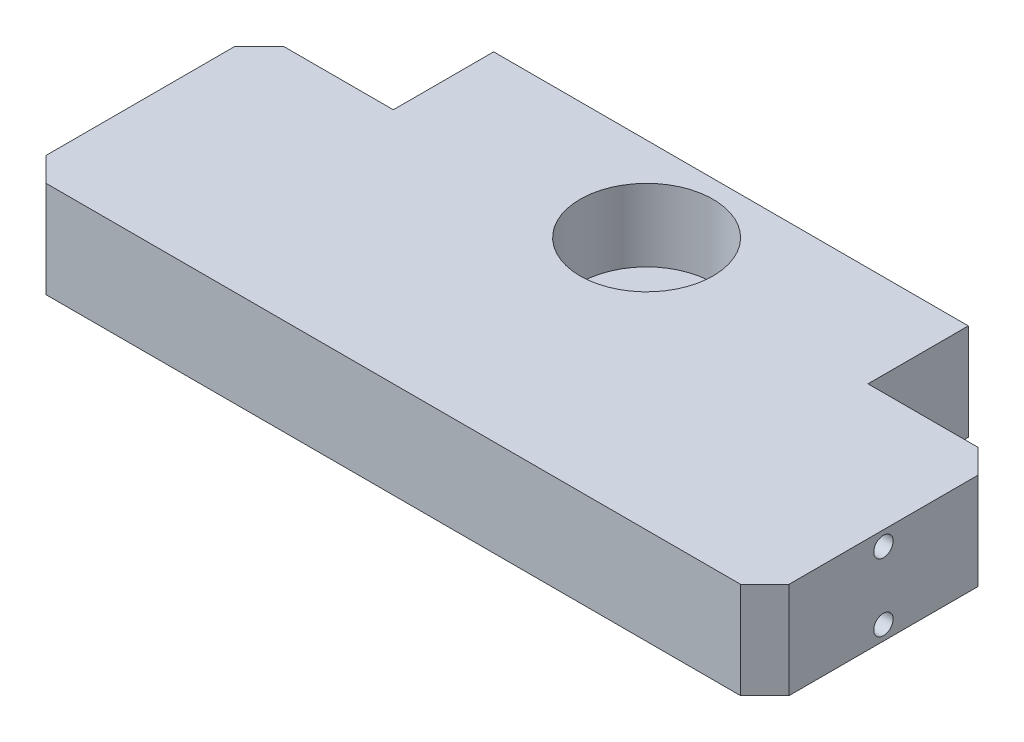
SolidWorks part; units mm, degrees
ref_plane "Front Plane" through (0, 0, 0) normal (0, 0, 1) x (1, 0, 0)
ref_plane "Top Plane" through (0, 0, 0) normal (0, 1, 0) x (1, 0, 0)
ref_plane "Right Plane" through (0, 0, 0) normal (1, 0, 0) x (0, 0, -1)
sketch "Sketch1" plane through (0, 0, 0) normal (0, 1, 0) x (1, 0, 0)
  line L1 (0, 0) -> (195.58, 0)
  line L2 (0, 0) -> (0, 88.9)
  line L3 (0, 88.9) -> (195.58, 88.9)
  line L4 (195.58, 0) -> (195.58, 88.9)
  dimension "D1" = 88.9
  dimension "D2" = 195.58
extrude "Extrude1" add sketch "Sketch1" along normal blind 25.4
sketch "Sketch2" plane through (0, 25.4, 0) normal (0, 1, 0) x (-1, 0, 0)
  line L1 (-195.58, 0) -> (-195.58, -88.9) construction
  line L2 (0, 0) -> (-195.58, 0) construction
  circle A0 centre (-97.79, -66.675) radius 17.5006
  dimension "D1" = 35.0012
  dimension "D2" = 66.675
  dimension "D3" = 97.79
extrude "Cut-Extrude1" cut sketch "Sketch2" against normal blind 19.05
sketch "Sketch3" plane through (0, 0, 0) normal (0, -1, 0) x (1, 0, 0)
  circle A0 centre (97.79, -66.675) radius 4.953
  dimension "D1" = 9.906
extrude "Cut-Extrude2" cut sketch "Sketch3" against normal through all
sketch "Sketch4" plane through (0, 0, 0) normal (0, -1, 0) x (1, 0, 0)
  line L0 (0, 0) -> (195.58, 0) construction
  line L1 (0, -88.9) -> (35.306, -88.9)
  line L2 (0, -88.9) -> (0, -62.484)
  line L3 (0, -62.484) -> (35.306, -62.484)
  line L4 (35.306, -88.9) -> (35.306, -62.484)
  line L5 (195.58, -88.9) -> (160.274, -88.9)
  line L6 (195.58, -88.9) -> (195.58, -62.484)
  line L7 (195.58, -62.484) -> (160.274, -62.484)
  line L8 (160.274, -88.9) -> (160.274, -62.484)
  dimension "D1" = 35.306
  dimension "D2" = 35.306
  dimension "D3" = 62.484
  dimension "D4" = 62.484
extrude "Cut-Extrude3" cut sketch "Sketch4" against normal through all
hole_wizard "1/4-20 Tapped Hole1" positions "3DSketch1" profile "Sketch5" tap size "1/4-20" standard "Ansi Inch"
sketch3d "3DSketch1"
  line L0 (195.58, 0, 0) -> (195.58, 0, -62.484) construction
  line L2 (195.58, 25.4, -62.484) -> (195.58, 0, -62.484) construction
  point P0 (195.58, 3.81, -31.242)
  point P2 (195.58, 21.59, -31.242)
  point P11 (222.3515, 0, -45.1579)
  dimension "D1" = 17.78
  dimension "D2" = 3.81
  dimension "D3" = 31.242
sketch "Sketch5" plane through (195.58, 3.81, -31.242) normal (0, 1, 0) x (0, 0, -1)
  line L0 (0, 0) -> (0, 20.5838)
  line L1 (0, 20.5838) -> (2.5527, 19.05)
  line L2 (2.5527, 19.05) -> (2.5527, 0)
  line L5 (2.5527, 0) -> (0, 0)
  line L10 (0, 20.5838) -> (-2.5527, 19.05) construction
  line L11 (0, -6.35) -> (0, 107.95) construction
  dimension "Tap Drill Dia." = 5.1054
  dimension "Tap Drill Depth" = 19.05
  dimension "Drill Angle" = 118
hole_wizard "1/4-20 Tapped Hole2" positions "3DSketch2" profile "Sketch6" tap size "1/4-20" standard "Ansi Inch"
sketch3d "3DSketch2"
  line L0 (0, 25.4, -62.484) -> (0, 25.4, 0) construction
  line L1 (0, 25.4, 0) -> (0, 0, 0) construction
  point P0 (0, 21.59, -31.242)
  point P2 (0, 3.81, -31.242)
  dimension "D1" = 3.81
  dimension "D2" = 17.78
  dimension "D3" = 31.242
sketch "Sketch6" plane through (0, 21.59, -31.242) normal (0, 1, 0) x (0, 0, 1)
  line L0 (0, 0) -> (0, 20.5838)
  line L1 (0, 20.5838) -> (2.5527, 19.05)
  line L2 (2.5527, 19.05) -> (2.5527, 0)
  line L5 (2.5527, 0) -> (0, 0)
  line L10 (0, 20.5838) -> (-2.5527, 19.05) construction
  line L11 (0, -6.35) -> (0, 107.95) construction
  dimension "Tap Drill Dia." = 5.1054
  dimension "Tap Drill Depth" = 19.05
  dimension "Drill Angle" = 118
chamfer "Chamfer1" distance 6.35 angle 45 4 edges at (0, 12.7, 0) (0, 12.7, -62.484) (195.58, 12.7, 0) (195.58, 12.7, -62.484)
